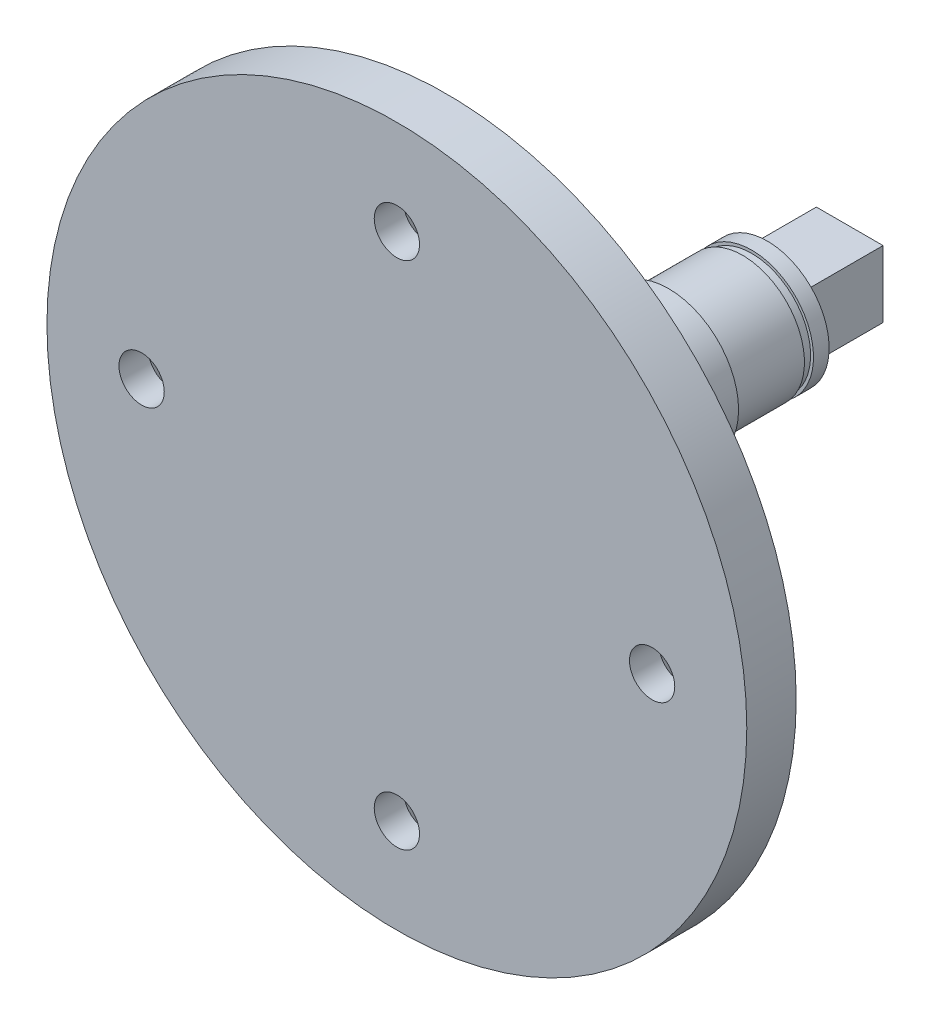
SolidWorks part; units mm, degrees
ref_plane "Przednia" through (0, 0, 0) normal (0, 0, 1) x (1, 0, 0)
ref_plane "Górna" through (0, 0, 0) normal (0, 1, 0) x (1, 0, 0)
ref_plane "Prawa" through (0, 0, 0) normal (1, 0, 0) x (0, 0, -1)
sketch "Szkic1" plane through (0, 0, 0) normal (0, 0, 1) x (1, 0, 0)
  circle A0 centre (0, 0) radius 42.5
  dimension "D1" = 85
extrude "Dodanie-wyciągnięcie1" add sketch "Szkic1" along normal blind 6
sketch "Szkic2" plane through (0, 0, 0) normal (0, 0, -1) x (-1, 0, 0)
  circle A0 centre (0, 0) radius 7.5
  dimension "D1" = 15
extrude "Dodanie-wyciągnięcie2" add sketch "Szkic2" along normal blind 39
sketch "Szkic3" plane through (0, 0, 0) normal (0, 0, -1) x (-1, 0, 0)
  circle A0 centre (0, 0) radius 8.5
  dimension "D1" = 17
extrude "Dodanie-wyciągnięcie3" add sketch "Szkic3" along normal offset from surface (27 mm away) 12
sketch "Szkic4" plane through (0, 0, -39) normal (0, 0, -1) x (-1, 0, 0)
  line L0 (0, 0) -> (0, -4.05) construction
  line L1 (-4.05, -4.05) -> (4.05, -4.05)
  line L2 (-4.05, -4.05) -> (-4.05, 4.05)
  line L3 (-4.05, 4.05) -> (4.05, 4.05)
  line L4 (4.05, -4.05) -> (4.05, 4.05)
  line L5 (0, 0) -> (4.05, 0) construction
  dimension "D1" = 8.1
  dimension "D2" = 8.1
extrude "Dodanie-wyciągnięcie4" add sketch "Szkic4" along normal blind 10
hole_wizard "Pogłębienie stożkowe pod M5 wkręt do części metalowych z łbem soczewkowym1" positions "Szkic6" profile "Szkic5" countersink size "M5" standard "Ansi Metric"
sketch "Szkic6" plane through (0, 0, 0) normal (0, 0, -1) x (-1, 0, 0)
  line L0 (0, 31) -> (0, 0) construction
  point P0 (0, 31)
  point P13 (31, 0)
  point P14 (0, -31)
  point P15 (-31, 0)
  dimension "D1" = 31
  dimension "D2" = 4
sketch "Szkic5" plane through (0, 31, 0) normal (1, 0, 0) x (0, 1, 0)
  line L0 (0, 0) -> (0, 6)
  line L1 (0, 6) -> (2.75, 6)
  line L2 (2.75, 6) -> (2.75, 2.45)
  line L3 (2.75, 2.45) -> (5.2, 0)
  line L5 (5.2, 0) -> (0, 0)
  line L6 (-2.75, 2.45) -> (-5.2, 0) construction
  line L11 (0, -6.35) -> (0, 107.95) construction
  dimension "Średnica otworu na wylot" = 5.5
  dimension "Głębokość otworu na wylot" = 6
  dimension "Średnica zewnętrznego pogłębienia stożkowego" = 10.4
  dimension "Kąt zewnętrznego pogłębienia stożkowego" = 90
ref_plane "Płaszczyzna1" through (0, 0, -36) normal (0, 0, -1) x (-1, 0, 0)
sketch "Szkic7" plane through (0, 0, -36) normal (0, 0, -1) x (-1, 0, 0)
  circle A0 centre (0, 0) radius 7.15
  circle A1 centre (0, 0) radius 7.5
  circle A2 centre (0, 0) radius 7.5 construction
  dimension "D1" = 14.3
extrude "Wytnij-wyciągnięcie1" cut sketch "Szkic7" along normal blind 1.1
